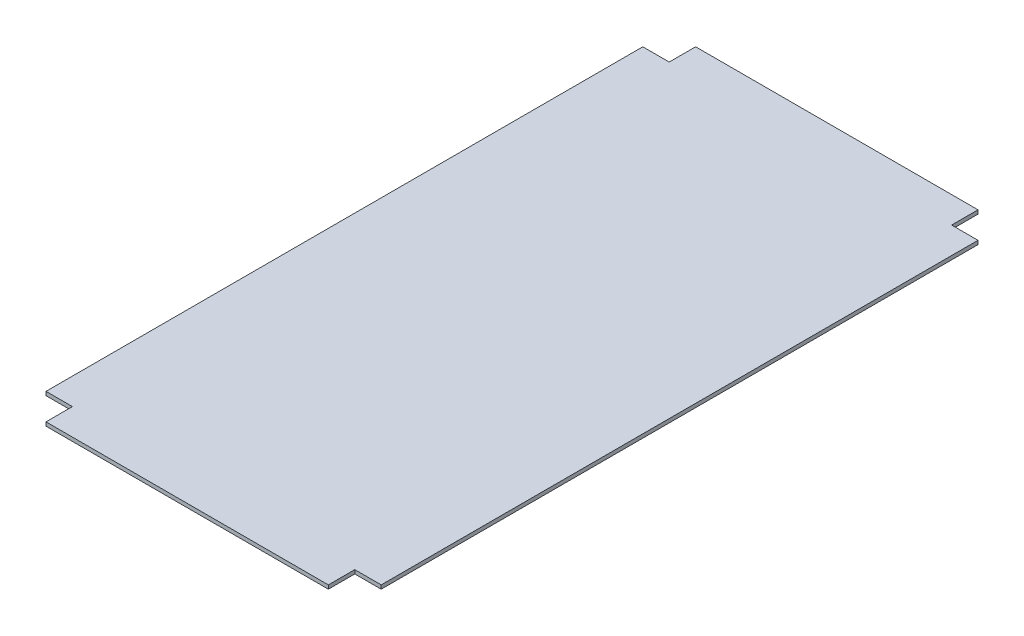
SolidWorks part; units mm, degrees
ref_plane "Alzado" through (0, 0, 0) normal (0, 0, 1) x (1, 0, 0)
ref_plane "Planta" through (0, 0, 0) normal (0, 1, 0) x (1, 0, 0)
ref_plane "Vista lateral" through (0, 0, 0) normal (1, 0, 0) x (0, 0, -1)
sketch "Croquis1" plane through (0, 0, 0) normal (0, 0, 1) x (1, 0, 0)
  line L0 (266.5, 3) -> (-266.5, -3) construction
  line L1 (-266.5, 3) -> (266.5, 3)
  line L2 (-266.5, 3) -> (-266.5, -3)
  line L3 (-266.5, -3) -> (266.5, -3)
  line L4 (266.5, 3) -> (266.5, -3)
extrude "Extruir1" add sketch "Croquis1" along normal mid plane 1033
sketch "Croquis2" plane through (0, 3, 0) normal (0, 1, 0) x (1, 0, 0)
  line L0 (0, 0) -> (-468.0732, 0) construction
  line L1 (-266.5, 516.5) -> (-224.5, 516.5)
  line L2 (-266.5, 516.5) -> (-266.5, 474.5)
  line L3 (-266.5, 474.5) -> (-224.5, 474.5)
  line L4 (-224.5, 516.5) -> (-224.5, 474.5)
  line L5 (-224.5, -516.5) -> (-224.5, -474.5)
  line L6 (-266.5, -474.5) -> (-224.5, -474.5)
  line L7 (-266.5, -516.5) -> (-266.5, -474.5)
  line L8 (-266.5, -516.5) -> (-224.5, -516.5)
  line L9 (0, 0) -> (0, 546.9955) construction
  line L10 (224.5, 516.5) -> (224.5, 474.5)
  line L11 (266.5, 474.5) -> (224.5, 474.5)
  line L12 (266.5, 516.5) -> (266.5, 474.5)
  line L13 (266.5, 516.5) -> (224.5, 516.5)
  line L14 (266.5, -516.5) -> (224.5, -516.5)
  line L15 (266.5, -516.5) -> (266.5, -474.5)
  line L16 (266.5, -474.5) -> (224.5, -474.5)
  line L17 (224.5, -516.5) -> (224.5, -474.5)
  dimension "D1" = 42
  dimension "D2" = 42
extrude "Esquinas" cut sketch "Croquis2" against normal through all
